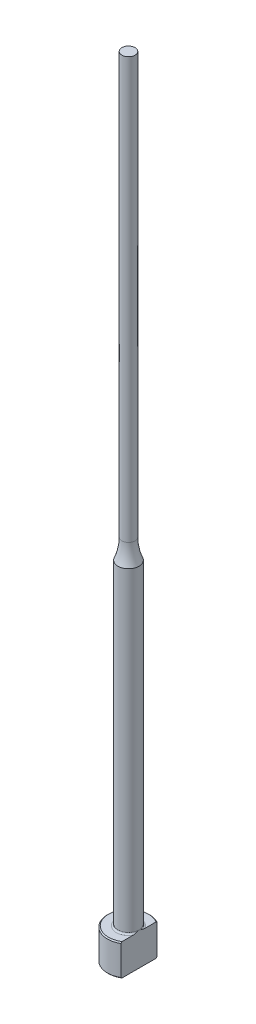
SolidWorks part; units mm, degrees
ref_plane "Front Plane" through (0, 0, 0) normal (0, 0, 1) x (1, 0, 0)
ref_plane "Top Plane" through (0, 0, 0) normal (0, 1, 0) x (1, 0, 0)
ref_plane "Right Plane" through (0, 0, 0) normal (1, 0, 0) x (0, 0, -1)
sketch "Sketch1" plane through (0, 0, 0) normal (0, 0, 1) x (1, 0, 0)
  line L0 (0, 259.9588) -> (0, -15.1925) construction
  line L1 (0, 0) -> (-4, 0)
  line L2 (-4, 0) -> (-4, 6)
  line L3 (-4, 6) -> (-2, 6)
  line L4 (-1.25, 70) -> (-1.25, 150)
  line L5 (-1.25, 150) -> (0, 150)
  line L6 (0, 150) -> (0, 0)
  line L7 (-2, 6) -> (-2, 66.2003)
  arc A0 (-2, 66.2003) -> (-1.25, 70) centre (-11.25, 70) ccw
  point P13 (-2, 0)
  dimension "D1" = 10
  dimension "L" = 150
  dimension "H" = 8
  dimension "T" = 6
  dimension "D" = 2.5
  dimension "B" = 4
  dimension "S" = 70
revolve "Revolve1" add sketch "Sketch1" angle 360 about L0
chamfer "Chamfer1" distance 0.2 angle 45 2 edges at (0, 6, 4) (0, 0, 4)
fillet "Fillet1" radius 0.3 1 edges at (0, 6, 2)
sketch "Sketch2" plane through (0, 0, 0) normal (0, 1, 0) x (1, 0, 0)
  line L0 (2, -3.4641) -> (2, 3.4641)
  circle A0 centre (0, 0) radius 4 construction
  arc A1 (2, -3.4641) -> (2, 3.4641) centre (0, 0) ccw
  circle A2 centre (0, 0) radius 2 construction
extrude "Keyed Head" cut sketch "Sketch2" along normal through all
